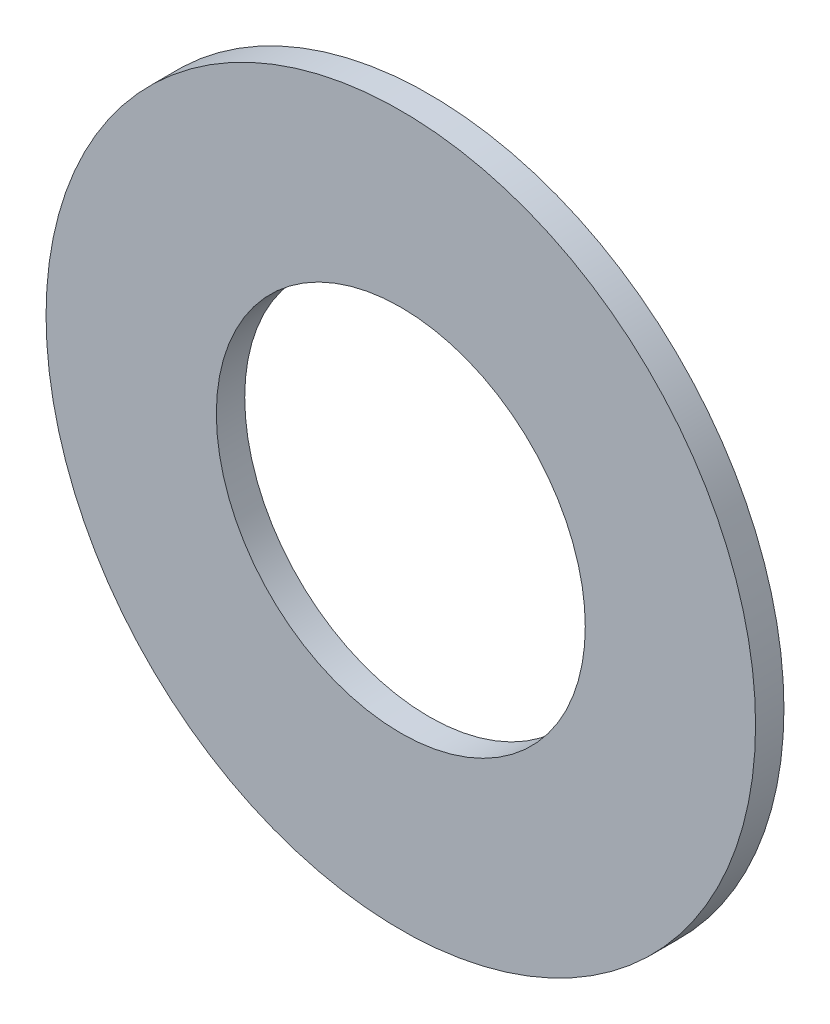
SolidWorks part; units mm, degrees
ref_plane "Front Plane" through (0, 0, 0) normal (0, 0, 1) x (1, 0, 0)
ref_plane "Top Plane" through (0, 0, 0) normal (0, 1, 0) x (1, 0, 0)
ref_plane "Right Plane" through (0, 0, 0) normal (1, 0, 0) x (0, 0, -1)
sketch "Sketch1" plane through (0, 0, 0) normal (0, 0, 1) x (1, 0, 0)
  circle A0 centre (0, 0) radius 3.302
  circle A1 centre (0, 0) radius 6.35
  dimension "ID" = 6.604
  dimension "OD" = 12.7
extrude "Extrude1" add sketch "Sketch1" against normal blind 0.508
